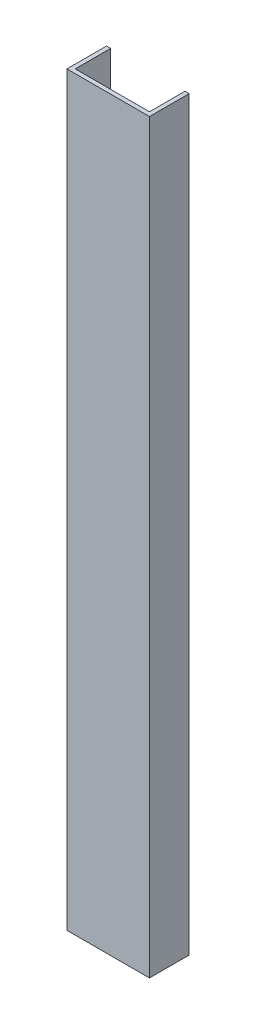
SolidWorks part; units mm, degrees
ref_plane "Front Plane" through (0, 0, 0) normal (0, 0, 1) x (1, 0, 0)
ref_plane "Top Plane" through (0, 0, 0) normal (0, 1, 0) x (1, 0, 0)
ref_plane "Right Plane" through (0, 0, 0) normal (1, 0, 0) x (0, 0, -1)
sketch "Sketch1" plane through (0, 0, 0) normal (0, 1, 0) x (1, 0, 0)
  line L0 (45, 48) -> (45, 5)
  line L1 (-50, 0) -> (50, 0)
  line L2 (-50, 0) -> (-50, 48)
  line L3 (-50, 48) -> (-45, 48)
  line L4 (50, 0) -> (50, 48)
  line L5 (45, 5) -> (-45, 5)
  line L6 (-45, 5) -> (-45, 48)
  line L7 (45, 48) -> (50, 48)
  dimension "D3" = 5
  dimension "D1" = 100
  dimension "D2" = 48
  dimension "D4" = 5
extrude "Boss-Extrude1" add sketch "Sketch1" along normal blind 904
